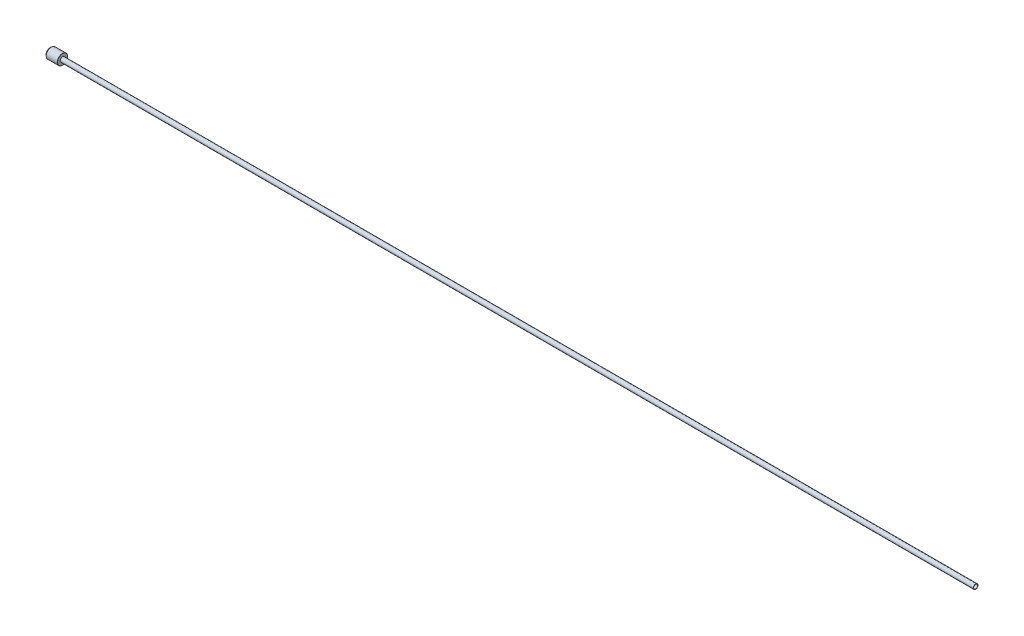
SolidWorks part; units mm, degrees
ref_plane "Front Plane" through (0, 0, 0) normal (0, 0, 1) x (1, 0, 0)
ref_plane "Top Plane" through (0, 0, 0) normal (0, 1, 0) x (1, 0, 0)
ref_plane "Right Plane" through (0, 0, 0) normal (1, 0, 0) x (0, 0, -1)
sketch "Sketch1" plane through (0, 0, 0) normal (0, 0, 1) x (1, 0, 0)
  line L0 (0.55, 2.5) -> (5, 2.5)
  line L1 (6, 1.143) -> (450, 1.143)
  line L2 (5, 2.5) -> (6, 2.5)
  line L4 (6, 2.5) -> (6, 1.143)
  line L5 (450, 1.143) -> (450, 0.9652)
  line L7 (450, 0.9652) -> (0, 0.9652)
  line L8 (0, 0.9652) -> (0, 2.05)
  line L9 (-22.2122, 0) -> (63.2184, 0) construction
  line L10 (0, 2.05) -> (0.1, 2.05)
  line L12 (0.1, 2.05) -> (0.55, 2.5)
  dimension "D2" = 5
  dimension "Thread" = 5
  dimension "D3" = 6
  dimension "D4" = 1.9304
  dimension "D5" = 2.286
  dimension "D6" = 450
  dimension "minor diameter" = 4.1
  dimension "D9" = 45
  dimension "D10" = 0.1
revolve "Revolve1" add sketch "Sketch1" angle 360 about L9
fillet "Fillet1" radius 0.1 1 edges at (6, 0, 2.5)
